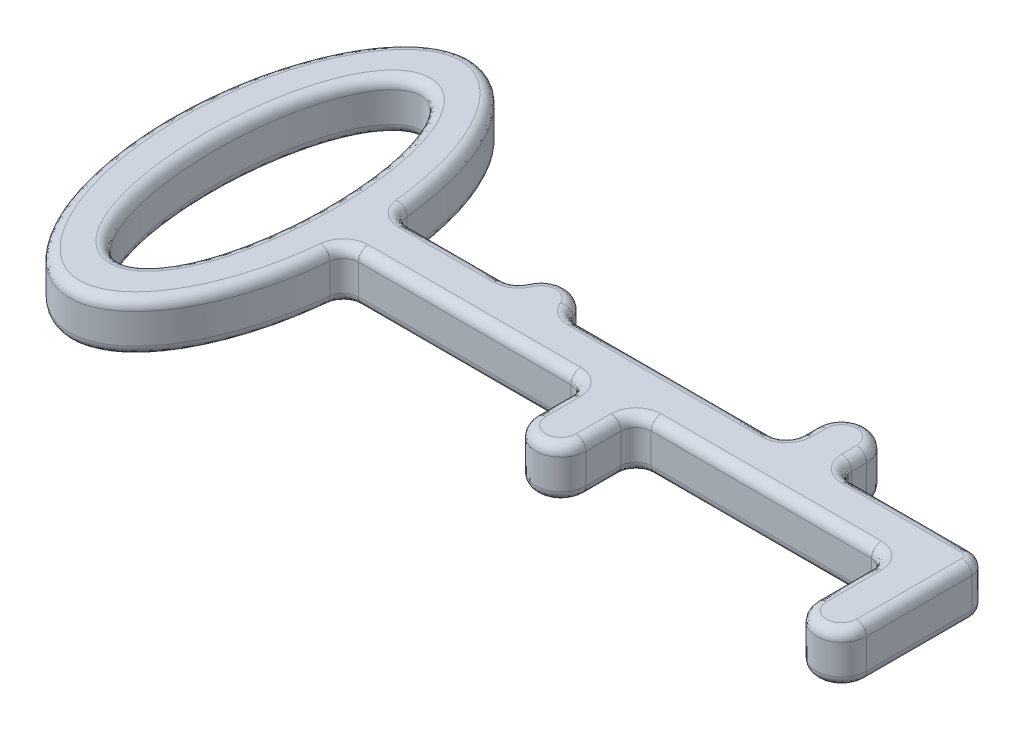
SolidWorks part; units mm, degrees
ref_plane "Front Plane" through (0, 0, 0) normal (0, 0, 1) x (1, 0, 0)
ref_plane "Top Plane" through (0, 0, 0) normal (0, 1, 0) x (1, 0, 0)
ref_plane "Right Plane" through (0, 0, 0) normal (1, 0, 0) x (0, 0, -1)
sketch "Sketch1" plane through (0, 0, 0) normal (0, 1, 0) x (1, 0, 0)
  line L4 (0, 2.5) -> (0, -2.5) construction
  line L5 (-0.0784, 2.5) -> (59, 2.5)
  line L6 (-1, 2.5) -> (-1, -2.5) construction
  line L7 (-0.0784, -2.5) -> (59, -2.5)
  line L8 (59, 2.5) -> (59, -2.5)
  ellipse E0 centre (-10, 0) end of major axis (-10, 20) minor radius 10 (-0.0784, 2.5) -> (-0.0784, -2.5) ccw
  ellipse E1 centre (-10, 0) end of major axis (-10, 15) minor radius 5.5
  point P13 (0, 0)
  dimension "D1" = 5
  dimension "D2" = 60
  dimension "D3" = 40
  dimension "D4" = 20
  dimension "D5" = 1
  dimension "D6" = 4.5
  dimension "D7" = 5
extrude "Boss-Extrude1" add sketch "Sketch1" along normal blind 5 contours E0 L7 L8 L5
sketch "Sketch2" plane through (0, 0, 0) normal (0, 1, 0) x (1, 0, 0)
  line L0 (59, 2.5) -> (-0.0784, 2.5) construction
  line L1 (17, 2.5) -> (12, 2.5)
  line L2 (24, -2.5) -> (29, -2.5)
  line L3 (-0.0784, -2.5) -> (59, -2.5) construction
  line L4 (29, -2.5) -> (29, -7.5)
  line L5 (24, -7.5) -> (24, -2.5)
  line L6 (39, 2.5) -> (39, 5.5)
  line L7 (39, 2.5) -> (44, 2.5)
  line L8 (44, 2.5) -> (44, 5.5)
  line L9 (59, -2.5) -> (59, -9.5)
  line L10 (59, -2.5) -> (54, -2.5)
  line L11 (54, -2.5) -> (54, -9.5)
  arc A0 (12, 2.5) -> (17, 2.5) centre (14.5, 2.5) cw
  arc A1 (29, -7.5) -> (24, -7.5) centre (26.5, -7.5) cw
  arc A2 (39, 5.5) -> (44, 5.5) centre (41.5, 5.5) cw
  arc A3 (59, -9.5) -> (54, -9.5) centre (56.5, -9.5) cw
  point P24 (0, 0)
  dimension "D1" = 5
  dimension "D6" = 5
  dimension "D9" = 5
  dimension "D2" = 5
  dimension "D3" = 5
  dimension "D4" = 12
  dimension "D5" = 7
  dimension "D7" = 3
  dimension "D8" = 10
  dimension "D10" = 7
extrude "Boss-Extrude2" add sketch "Sketch2" along normal blind 5
fillet "Fillet2" radius 1.5 10 edges at (59, 2.5, -2.5) (54, 2.5, 2.5) (44, 2.5, -2.5) (39, 2.5, -2.5) (24, 2.5, 2.5) (29, 2.5, 2.5) (12, 2.5, -2.5) (17, 2.5, -2.5) (-0.0784, 2.5, 2.5) (-0.0784, 2.5, -2.5)
fillet "Fillet3" radius 1 54 edges at (-10, 5, -15) (-10, 0, -15) (44.4393, 5, -2.9393) (44.4393, 0, -2.9393) (44, 5, -4.75) (44, 0, -4.75) (41.5, 0, -8) (41.5, 5, -8) (39, 0, -4.75) (39, 5, -4.75) (38.5607, 5, -2.9393) (38.5607, 0, -2.9393) (27.854, 0, -2.5) (27.854, 5, -2.5) (17.3696, 5, -2.7563) (17.3696, 0, -2.7563) (14.5, 5, -5) (14.5, 0, -5) (11.6304, 5, -2.7563) (11.6304, 0, -2.7563) (6.0487, 0, -2.5) (6.0487, 5, -2.5) (0.2979, 5, -2.8887) (0.2979, 0, -2.8887) (-20, 0, 0) (-20, 5, 0) (0.2979, 5, 2.8887) (0.2979, 0, 2.8887) (11.9027, 0, 2.5) (11.9027, 5, 2.5) (23.5607, 5, 2.9393) (23.5607, 0, 2.9393) (24, 5, 5.75) (24, 0, 5.75) (26.5, 0, 10) (26.5, 5, 10) (29, 0, 5.75) (29, 5, 5.75) (29.4393, 5, 2.9393) (29.4393, 0, 2.9393) (41.5, 0, 2.5) (41.5, 5, 2.5) (53.5607, 5, 2.9393) (53.5607, 0, 2.9393) (54, 5, 6.75) (54, 0, 6.75) (56.5, 0, 12) (56.5, 5, 12) (59, 0, 4.25) (59, 5, 4.25) (58.5607, 5, -2.0607) (58.5607, 0, -2.0607) (51.5, 0, -2.5) (51.5, 5, -2.5)
